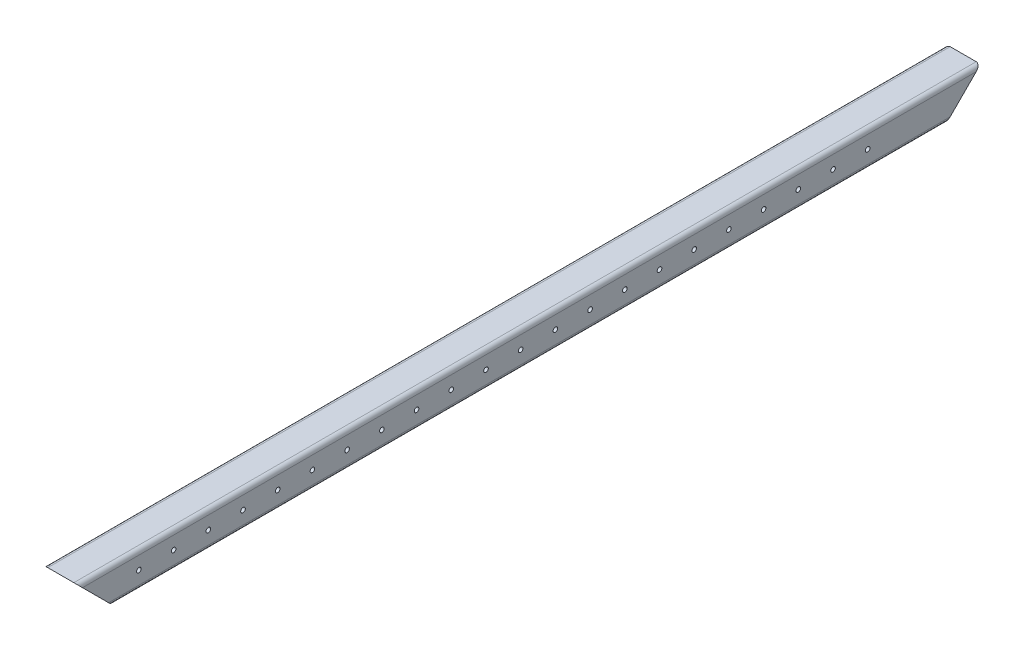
SolidWorks part; units mm, degrees
ref_plane "Front Plane" through (0, 0, 0) normal (0, 0, 1) x (1, 0, 0)
ref_plane "Top Plane" through (0, 0, 0) normal (0, 1, 0) x (1, 0, 0)
ref_plane "Right Plane" through (0, 0, 0) normal (1, 0, 0) x (0, 0, -1)
sketch "Sketch1" plane through (0, 0, 0) normal (0, 0, 1) x (1, 0, 0)
  line L0 (-19.05, -19.05) -> (-19.05, 19.05)
  line L1 (-19.05, -25.4) -> (19.05, -25.4)
  line L2 (-25.4, -19.05) -> (-25.4, 19.05)
  line L3 (-19.05, 25.4) -> (19.05, 25.4)
  line L4 (25.4, -19.05) -> (25.4, 19.05)
  line L5 (-19.05, 19.05) -> (19.05, 19.05)
  line L6 (19.05, -19.05) -> (19.05, 19.05)
  line L7 (-19.05, -19.05) -> (19.05, -19.05)
  arc A0 (-19.05, -25.4) -> (-25.4, -19.05) centre (-19.05, -19.05) cw
  arc A1 (19.05, -25.4) -> (25.4, -19.05) centre (19.05, -19.05) ccw
  arc A2 (19.05, 25.4) -> (25.4, 19.05) centre (19.05, 19.05) cw
  arc A3 (-25.4, 19.05) -> (-19.05, 25.4) centre (-19.05, 19.05) cw
  arc A4 (-19.05, 19.05) -> (-19.05, 19.05) centre (-19.05, 19.05) cw
  arc A5 (19.05, 19.05) -> (19.05, 19.05) centre (19.05, 19.05) cw
  arc A6 (19.05, -19.05) -> (19.05, -19.05) centre (19.05, -19.05) ccw
  arc A7 (-19.05, -19.05) -> (-19.05, -19.05) centre (-19.05, -19.05) cw
  dimension "D5" = 6.35
  dimension "D1" = 50.8
  dimension "D2" = 50.8
  dimension "D3" = 25.4
  dimension "D4" = 25.4
  dimension "D6" = 6.35
extrude "Boss-Extrude1" add sketch "Sketch1" against normal blind 1320.8
sketch "Sketch2" plane through (25.4, 0, 0) normal (1, 0, 0) x (0, 0, -1)
  line L0 (0, 25.4) -> (50.8, -25.4)
  line L1 (1320.8, -25.4) -> (0, -25.4) construction
  line L2 (0, -19.05) -> (0, 19.05) construction
  dimension "D1" = 45
extrude "Cut-Extrude1" cut sketch "Sketch2" against normal through all and the other way through all flip side to cut
sketch "Sketch3" plane through (25.4, 0, 0) normal (1, 0, 0) x (0, 0, -1)
  line L0 (1320.8, 25.4) -> (1270, -25.4)
  line L1 (1320.8, -25.4) -> (50.8, -25.4) construction
  line L2 (1320.8, -19.05) -> (1320.8, 19.05) construction
  dimension "D1" = 45
extrude "Cut-Extrude2" cut sketch "Sketch3" against normal through all and the other way through all
sketch "Sketch4" plane through (25.4, 0, 0) normal (1, 0, 0) x (0, 0, -1)
  circle A1 centre (88.9, 0) radius 3.3655
  circle A2 centre (139.7, 0) radius 3.3655
  circle A3 centre (190.5, 0) radius 3.3655
  circle A4 centre (241.3, 0) radius 3.3655
  circle A5 centre (292.1, 0) radius 3.3655
  circle A6 centre (342.9, 0) radius 3.3655
  circle A7 centre (393.7, 0) radius 3.3655
  circle A8 centre (444.5, 0) radius 3.3655
  circle A9 centre (495.3, 0) radius 3.3655
  circle A10 centre (546.1, 0) radius 3.3655
  circle A11 centre (596.9, 0) radius 3.3655
  circle A12 centre (647.7, 0) radius 3.3655
  circle A13 centre (698.5, 0) radius 3.3655
  circle A14 centre (749.3, 0) radius 3.3655
  circle A15 centre (800.1, 0) radius 3.3655
  circle A16 centre (850.9, 0) radius 3.3655
  circle A17 centre (901.7, 0) radius 3.3655
  circle A18 centre (952.5, 0) radius 3.3655
  circle A19 centre (1003.3, 0) radius 3.3655
  circle A20 centre (1054.1, 0) radius 3.3655
  circle A21 centre (1104.9, 0) radius 3.3655
  circle A22 centre (1155.7, 0) radius 3.3655
  dimension "D13" = 88.9
  dimension "D14" = 6.731
  dimension "D15" = 6.731
  dimension "D16" = 6.731
  dimension "D17" = 6.731
  dimension "D18" = 6.731
  dimension "D19" = 6.731
  dimension "D20" = 6.731
  dimension "D21" = 6.731
  dimension "D22" = 6.731
  dimension "D23" = 6.731
  dimension "D24" = 6.731
  dimension "D29" = 50.8
  dimension "D30" = 6.731
  dimension "D31" = 6.731
  dimension "D32" = 6.731
  dimension "D33" = 6.731
  dimension "D34" = 6.731
  dimension "D41" = 6.731
  dimension "D42" = 6.731
  dimension "D43" = 6.731
  dimension "D44" = 6.731
  dimension "D45" = 6.731
  dimension "D46" = 6.731
  dimension "D3" = 50.8
  dimension "D4" = 50.8
  dimension "D5" = 50.8
  dimension "D6" = 50.8
  dimension "D7" = 50.8
  dimension "D8" = 50.8
  dimension "D9" = 50.8
  dimension "D10" = 50.8
  dimension "D11" = 50.8
  dimension "D12" = 50.8
  dimension "D25" = 50.8
  dimension "D26" = 50.8
  dimension "D27" = 50.8
  dimension "D28" = 50.8
  dimension "D35" = 50.8
  dimension "D36" = 50.8
  dimension "D37" = 50.8
  dimension "D38" = 50.8
  dimension "D39" = 50.8
  dimension "D40" = 50.8
extrude "Cut-Extrude3" cut sketch "Sketch4" against normal blind 660.4
sketch "Sketch5" plane through (25.4, 0, 0) normal (1, 0, 0) x (0, 0, -1)
  line L0 (1320.8, 25.4) -> (0, 25.4) construction
  line L1 (584.2, 25.4) -> (635, 25.4)
  line L2 (584.2, 25.4) -> (584.2, -25.4)
  line L3 (584.2, -25.4) -> (635, -25.4)
  line L4 (635, 25.4) -> (635, -25.4)
  line L5 (1270, -25.4) -> (50.8, -25.4) construction
  line L6 (1320.8, 25.4) -> (1320.8, -25.4) construction
  dimension "D1" = 584.2
  dimension "D2" = 50.8
  dimension "D3" = 685.8
extrude "Cut-Extrude4" [suppressed] cut sketch "Sketch5" against normal through all
sketch "Sketch6" plane through (25.4, 0, 0) normal (1, 0, 0) x (0, 0, -1)
  line L0 (1320.8, 25.4) -> (0, 25.4) construction
  line L1 (635, 25.4) -> (685.8, 25.4)
  line L2 (635, 25.4) -> (635, -25.4)
  line L3 (635, -25.4) -> (685.8, -25.4)
  line L4 (685.8, 25.4) -> (685.8, -25.4)
  line L5 (1270, -25.4) -> (50.8, -25.4) construction
  dimension "D1" = 635
  dimension "D2" = 50.8
extrude "Cut-Extrude5" [suppressed] cut sketch "Sketch6" against normal through all
